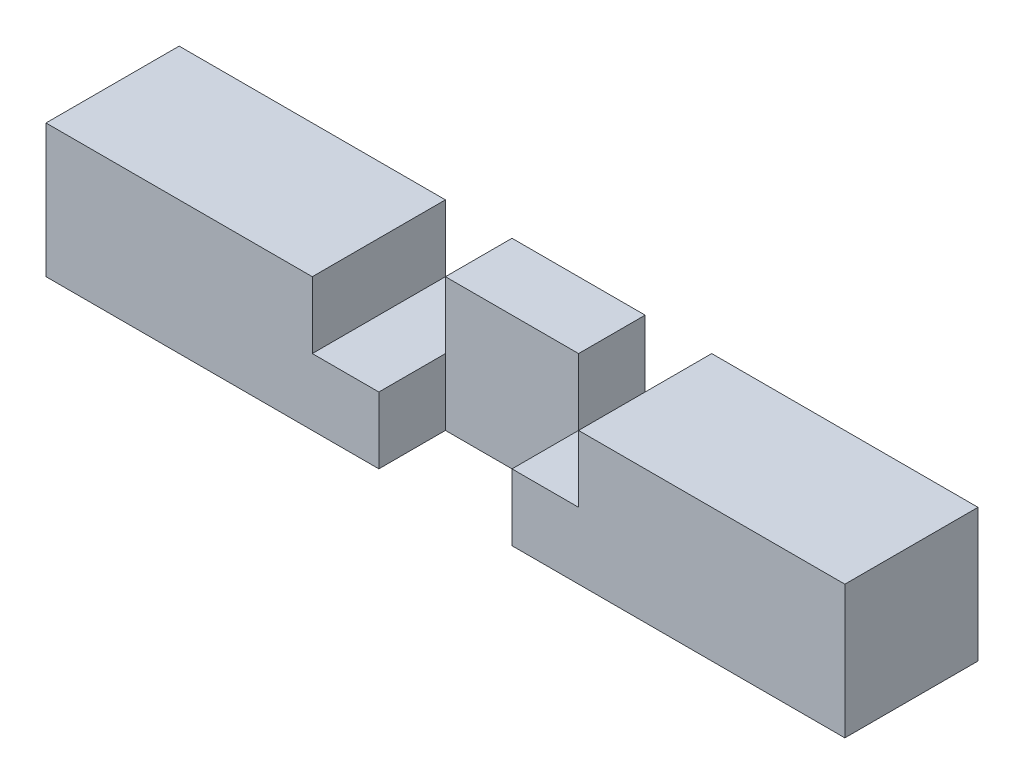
SolidWorks part; units mm, degrees
ref_plane "Front Plane" through (0, 0, 0) normal (0, 0, 1) x (1, 0, 0)
ref_plane "Top Plane" through (0, 0, 0) normal (0, 1, 0) x (1, 0, 0)
ref_plane "Right Plane" through (0, 0, 0) normal (1, 0, 0) x (0, 0, -1)
sketch "Sketch1" plane through (0, 0, 0) normal (0, 1, 0) x (1, 0, 0)
  line L1 (0, 0) -> (120, 0)
  line L2 (0, 0) -> (0, 20)
  line L3 (0, 20) -> (120, 20)
  line L4 (120, 0) -> (120, 20)
  dimension "D1" = 120
  dimension "D2" = 20
extrude "Extrude1" add sketch "Sketch1" along normal blind 20
sketch "Sketch2" plane through (0, 0, 0) normal (0, 0, 1) x (1, 0, 0)
  line L0 (0, 20) -> (120, 20) construction
  line L1 (40, 20) -> (50, 20)
  line L2 (40, 20) -> (40, 10)
  line L3 (40, 10) -> (50, 10)
  line L4 (50, 20) -> (50, 10)
  line L5 (0, 20) -> (0, 0) construction
  line L6 (70, 20) -> (80, 20)
  line L7 (70, 20) -> (70, 10)
  line L8 (70, 10) -> (80, 10)
  line L9 (80, 20) -> (80, 10)
  dimension "D1" = 40
  dimension "D2" = 10
  dimension "D3" = 20
  dimension "D4" = 10
  dimension "D5" = 10
  dimension "D6" = 10
extrude "Extrude2" cut sketch "Sketch2" against normal through all
sketch "Sketch3" plane through (0, 20, 0) normal (0, 1, 0) x (1, 0, 0)
  line L0 (70, 20) -> (70, 0) construction
  line L1 (50, 0) -> (70, 0)
  line L2 (50, 0) -> (50, 10)
  line L3 (50, 10) -> (70, 10)
  line L4 (70, 0) -> (70, 10)
extrude "Extrude3" cut sketch "Sketch3" against normal through all
